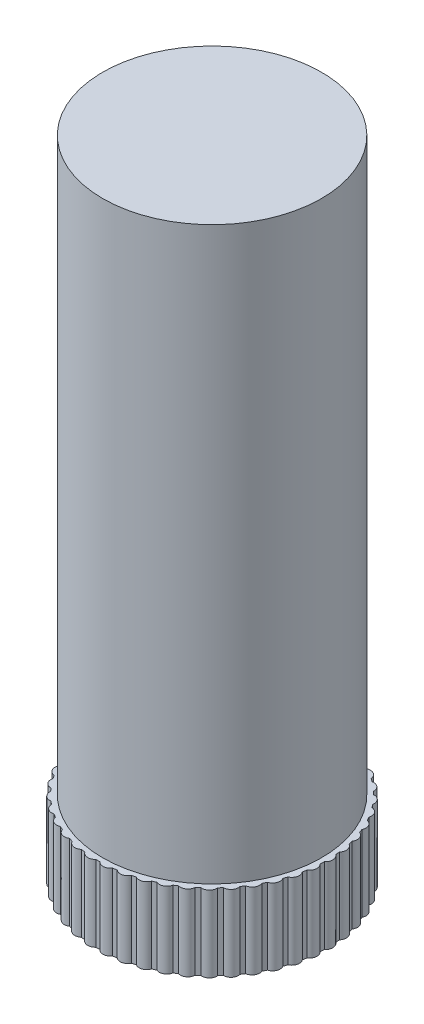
SolidWorks part; units mm, degrees
ref_plane "前视基准面" through (0, 0, 0) normal (0, 0, 1) x (1, 0, 0)
ref_plane "上视基准面" through (0, 0, 0) normal (0, 1, 0) x (1, 0, 0)
ref_plane "右视基准面" through (0, 0, 0) normal (1, 0, 0) x (0, 0, -1)
sketch "草图2" plane through (0, 0, 0) normal (0, 1, 0) x (1, 0, 0)
  circle A0 centre (0, 0) radius 6 construction
  circle A1 centre (0, 0) radius 5.75 construction
  circle A2 centre (0, 5.75) radius 0.3946
  circle A3 centre (0.8002, 5.694) radius 0.3946
  circle A4 centre (1.5849, 5.5273) radius 0.3946
  circle A5 centre (2.3387, 5.2529) radius 0.3946
  circle A6 centre (3.047, 4.8763) radius 0.3946
  circle A7 centre (3.696, 4.4048) radius 0.3946
  circle A8 centre (4.2731, 3.8475) radius 0.3946
  circle A9 centre (4.767, 3.2154) radius 0.3946
  circle A10 centre (5.1681, 2.5206) radius 0.3946
  circle A11 centre (5.4686, 1.7768) radius 0.3946
  circle A12 centre (5.6626, 0.9985) radius 0.3946
  circle A13 centre (5.7465, 0.2007) radius 0.3946
  circle A14 centre (5.7185, -0.601) radius 0.3946
  circle A15 centre (5.5792, -1.3911) radius 0.3946
  circle A16 centre (5.3313, -2.154) radius 0.3946
  circle A17 centre (4.9796, -2.875) radius 0.3946
  circle A18 centre (4.5311, -3.5401) radius 0.3946
  circle A19 centre (3.9943, -4.1362) radius 0.3946
  circle A20 centre (3.3798, -4.6518) radius 0.3946
  circle A21 centre (2.6995, -5.0769) radius 0.3946
  circle A22 centre (1.9666, -5.4032) radius 0.3946
  circle A23 centre (1.1955, -5.6243) radius 0.3946
  circle A24 centre (0.4011, -5.736) radius 0.3946
  circle A25 centre (-0.4011, -5.736) radius 0.3946
  circle A26 centre (-1.1955, -5.6243) radius 0.3946
  circle A27 centre (-1.9666, -5.4032) radius 0.3946
  circle A28 centre (-2.6995, -5.0769) radius 0.3946
  circle A29 centre (-3.3798, -4.6518) radius 0.3946
  circle A30 centre (-3.9943, -4.1362) radius 0.3946
  circle A31 centre (-4.5311, -3.5401) radius 0.3946
  circle A32 centre (-4.9796, -2.875) radius 0.3946
  circle A33 centre (-5.3313, -2.154) radius 0.3946
  circle A34 centre (-5.5792, -1.3911) radius 0.3946
  circle A35 centre (-5.7185, -0.601) radius 0.3946
  circle A36 centre (-5.7465, 0.2007) radius 0.3946
  circle A37 centre (-5.6626, 0.9985) radius 0.3946
  circle A38 centre (-5.4686, 1.7768) radius 0.3946
  circle A39 centre (-5.1681, 2.5206) radius 0.3946
  circle A40 centre (-4.767, 3.2154) radius 0.3946
  circle A41 centre (-4.2731, 3.8475) radius 0.3946
  circle A42 centre (-3.696, 4.4048) radius 0.3946
  circle A43 centre (-3.047, 4.8763) radius 0.3946
  circle A44 centre (-2.3387, 5.2529) radius 0.3946
  circle A45 centre (-1.5849, 5.5273) radius 0.3946
  circle A46 centre (-0.8002, 5.694) radius 0.3946
  point P97 (0, 0)
  dimension "D1" = 12
  dimension "D2" = 11.5
  dimension "D3" = 45
extrude "凸台-拉伸1" add sketch "草图2" along normal blind 4
sketch "草图3" plane through (0, 0, 0) normal (0, -1, 0) x (1, 0, 0)
  circle A0 centre (0, 0) radius 6
  dimension "D1" = 12
extrude "凸台-拉伸2" add sketch "草图3" against normal blind 4
sketch "草图4" plane through (0, 4, 0) normal (0, 1, 0) x (1, 0, 0)
  circle A0 centre (0, 0) radius 5.75
  dimension "D1" = 11.5
extrude "凸台-拉伸3" add sketch "草图4" along normal blind 30
sketch "草图5" plane through (0, 0, 0) normal (0, -1, 0) x (-1, 0, 0)
  circle A0 centre (0, 0) radius 3.5
  dimension "D1" = 7
extrude "切除-拉伸1" cut sketch "草图5" against normal blind 4
sketch "草图6" plane through (0, 4, 0) normal (0, -1, 0) x (-1, 0, 0)
  circle A0 centre (0, 0) radius 1.4242
extrude "切除-拉伸2" cut sketch "草图6" against normal blind 2 contours A0
